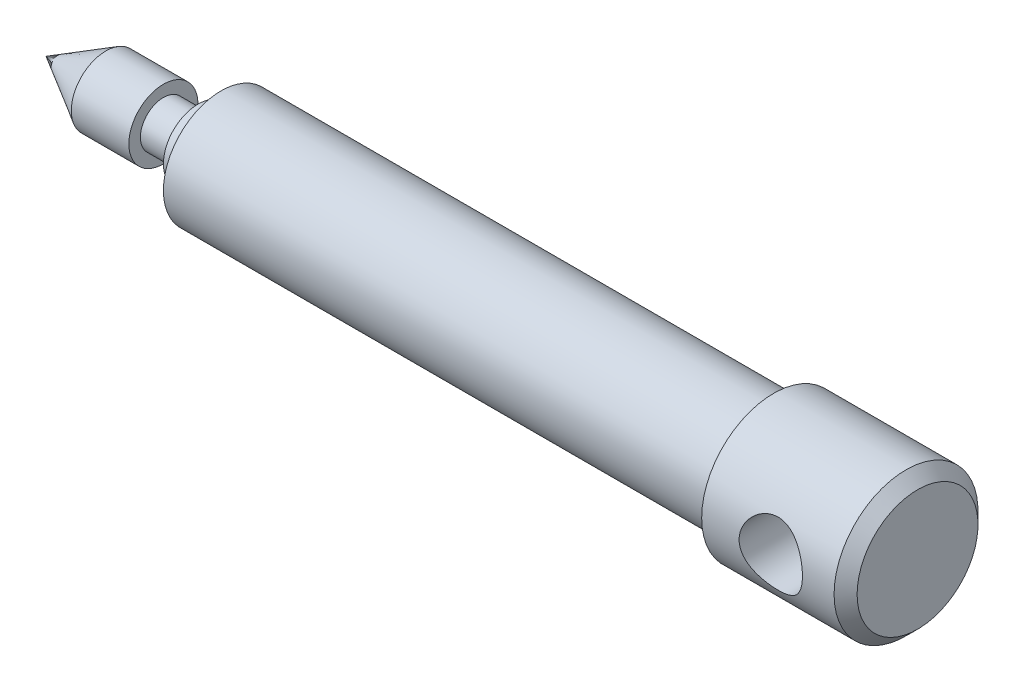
SolidWorks part; units mm, degrees
ref_plane "Front Plane" through (0, 0, 0) normal (0, 0, 1) x (1, 0, 0)
ref_plane "Top Plane" through (0, 0, 0) normal (0, 1, 0) x (1, 0, 0)
ref_plane "Right Plane" through (0, 0, 0) normal (1, 0, 0) x (0, 0, -1)
sketch "Sketch1" plane through (0, 0, 0) normal (0, 0, 1) x (1, 0, 0)
  line L0 (0, 0) -> (203.2022, 0) construction
  line L1 (0, 0) -> (10.3923, 6)
  line L2 (10.3923, 6) -> (20.3923, 6)
  line L3 (20.3923, 6) -> (20.3923, 4)
  line L4 (20.3923, 4) -> (26.3923, 4)
  line L5 (26.3923, 4) -> (26.3923, 6)
  line L6 (26.3923, 6) -> (30.3923, 6)
  line L7 (30.3923, 6) -> (30.3923, 10)
  line L8 (30.3923, 10) -> (126.3923, 10)
  line L9 (126.3923, 10) -> (126.3923, 12.5)
  line L10 (126.3923, 12.5) -> (151.3923, 12.5)
  line L11 (151.3923, 12.5) -> (151.3923, 0)
  line L12 (151.3923, 0) -> (0, 0)
  dimension "D1" = 12
  dimension "D2" = 8
  dimension "D3" = 20
  dimension "D4" = 25
  dimension "D5" = 10
  dimension "D6" = 4
  dimension "D7" = 96
  dimension "D8" = 25
  dimension "D9" = 30
  dimension "D10" = 6
revolve "Revolve1" add sketch "Sketch1" angle 360 about L0
chamfer "Chamfer1" distance 2 angle 45 1 edges at (151.3923, 0, 12.5)
sketch "Sketch2" plane through (0, 0, 0) normal (0, 0, 1) x (1, 0, 0)
  line L0 (151.3923, -10.5) -> (151.3923, 10.5) construction
  line L1 (126.3923, -12.5) -> (149.3923, -12.5) construction
  circle A0 centre (138.3923, 0) radius 5.5
  dimension "D1" = 11
  dimension "D2" = 13
  dimension "D3" = 12.5
extrude "Extrude1" cut sketch "Sketch2" against normal mid plane 30
